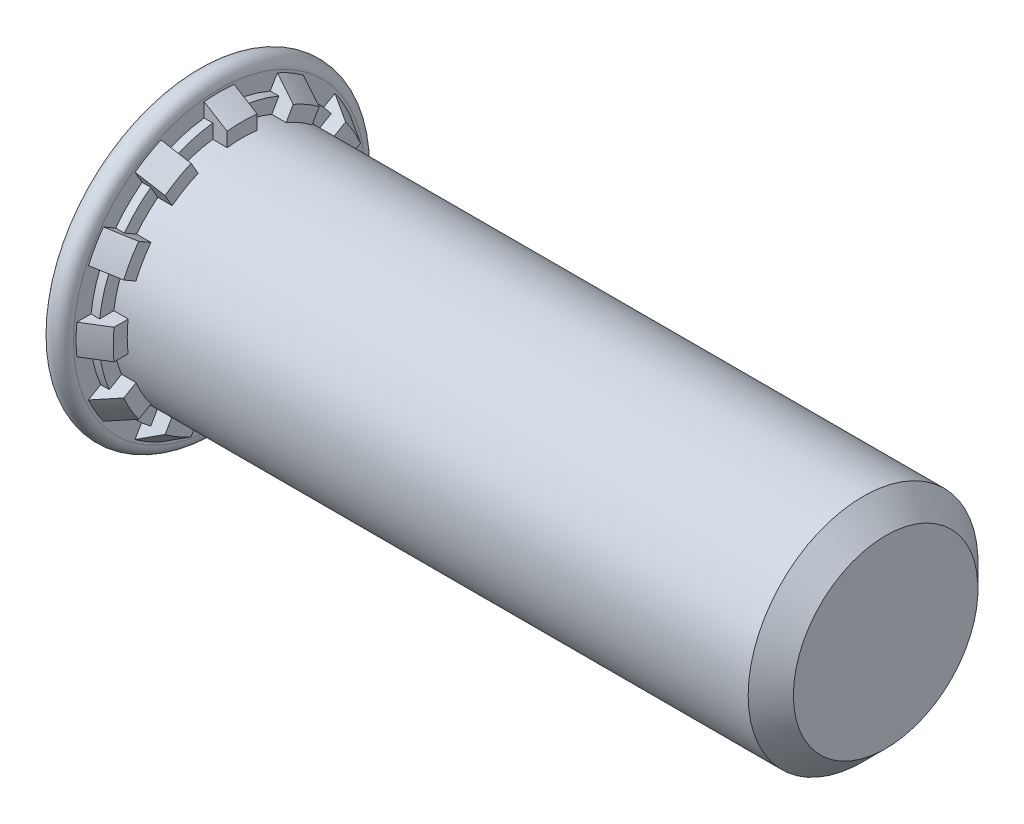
SolidWorks part; units mm, degrees
ref_plane "Plane1" through (0, 0, 0) normal (0, 0, 1) x (1, 0, 0)
ref_plane "Plane2" through (0, 0, 0) normal (0, 1, 0) x (1, 0, 0)
ref_plane "Plane3" through (0, 0, 0) normal (1, 0, 0) x (0, 0, -1)
sketch "BodySke" plane through (0, 0, 0) normal (0, 0, 1) x (1, 0, 0)
  line L0 (0, 0) -> (0, 3.7975)
  line L1 (0.6, 3.8025) -> (0.6, 3.735)
  line L2 (0.6, 3.735) -> (1.2, 3.3675)
  line L3 (1.2, 3) -> (17.4095, 3)
  line L4 (18, 2.4095) -> (18, 0)
  line L5 (18, 0) -> (0, 0)
  line L6 (0, 0) -> (50.554, 0) construction
  line L7 (1.2, 3.3675) -> (1.2, 3)
  line L8 (18, 2.4095) -> (17.4095, 3)
  line L9 (-9.525, 4.1) -> (9.525, 4.1) construction
  line L11 (2.2, 19.05) -> (2.2, -3.175) construction
  line L13 (9.525, -4.1) -> (-9.525, -4.1) construction
  line L14 (0.0051, 3.8025) -> (0.0051, 3.7975)
  line L15 (0, 3.7975) -> (0.0051, 3.7975)
  arc A0 (0.0051, 3.8025) -> (0.6, 3.8025) centre (0.3025, 3.8025) cw
  dimension "D2" = 0.0051
  dimension "D1" = 0.0051
  dimension "Diameter" = 6
  dimension "Length" = 18
  dimension "Body_ch_ang" = 45
  dimension "Minor_dia" = 4.819
  dimension "Advance" = 1
  dimension "H_dia" = 8.2
  dimension "Shoulder_lower_dia" = 7.47
  dimension "Shoulder_upper_dia" = 6.735
  dimension "Shoulder_ht" = 1.2
  dimension "T_dim" = 0.6
revolve "BaseBody" add sketch "BodySke" angle 360 about L6
sketch "ThdSchSke" plane through (0, 0, 0) normal (0, 0, 1) x (1, 0, 0)
  line L0 (3, -2.4095) -> (2.5865, -3)
  line L1 (3, -2.4095) -> (3.4135, -3)
  line L2 (3.4135, -3) -> (3.4135, -3.75)
  line L3 (-3.175, 0) -> (5.1513, 0) construction
  line L5 (3.4135, -3.75) -> (2.5865, -3.75)
  line L6 (2.5865, -3.75) -> (2.5865, -3)
  line L7 (0, 3.7975) -> (0, -3.7975) construction
  dimension "Thread_minor" = 4.819
  dimension "Diameter" = 6
  dimension "Start" = 3
  dimension "SideAngle" = 55
  dimension "VeeAngle" = 70
  dimension "Overcut" = 7.5
revolve "ThreadSchematic" [suppressed] cut sketch "ThdSchSke" angle 360 about L3
pattern_linear "ThdSchPat" [suppressed]
sketch "RibCut1Ske" plane through (1.2, 0, 0) normal (1, 0, 0) x (0, 0, -1)
  line L0 (0.3916, 2.9743) -> (0.3916, 4.0813)
  line L1 (1.1481, 2.7716) -> (1.7015, 3.7303)
  line L2 (0, 0) -> (0, 4.9784) construction
  line L3 (0, 0) -> (0.3916, 2.9743) construction
  line L4 (0, 0) -> (1.1481, 2.7716) construction
  arc A1 (1.1481, 2.7716) -> (0.3916, 2.9743) centre (0, 0) ccw
  arc A2 (1.7015, 3.7303) -> (0.3916, 4.0813) centre (0, 0) ccw
  dimension "Inner_dia" = 6
  dimension "Outer_dia" = 8.2
  dimension "Rib_root_half_angle" = 7.5
  dimension "Rib_root_gap_angle" = 15
  dimension "Angle" = 30
extrude "RibCut1" cut sketch "RibCut1Ske" against normal blind 0.375
sketch "RibCut2Ske" plane through (1.2, 0, 0) normal (1, 0, 0) x (0, 0, -1)
  line L0 (0.3916, 3.3447) -> (0.3916, 4.0813)
  line L1 (1.3332, 3.0923) -> (1.7015, 3.7303)
  line L2 (0.3916, 2.9743) -> (0.3916, 4.7861) construction
  line L3 (0, 0) -> (0, 5.0239) construction
  line L4 (0, 0) -> (0.3916, 2.9743) construction
  line L5 (0, 0) -> (1.1481, 2.7716) construction
  line L6 (1.1481, 2.7716) -> (2.0575, 4.3468) construction
  arc A1 (1.3332, 3.0923) -> (0.3916, 3.3447) centre (0, 0) ccw
  arc A2 (1.7015, 3.7303) -> (0.3916, 4.0813) centre (0, 0) ccw
  circle A4 centre (0, 0) radius 3 construction
  dimension "Inner_dia" = 6.735
  dimension "Outer_dia" = 8.2
  dimension "Rib_root_dia" = 6
  dimension "Rib_root_half_angle" = 7.5
  dimension "Rib_root_gap_angle" = 15
  dimension "Angle" = 30
extrude "RibCut2" cut sketch "RibCut2Ske" against normal blind 0.6
pattern_circular "RibCutsPat" count 12 every 30 about axis through (0, 0, 0) along (1, 0, 0) of "RibCut2", "RibCut1"
equation "' \"Length@BodySke\" = 18"
equation "' \"H_dia@BodySke\" = 8.2"
equation "' \"Start@ThdSchSke\" = 3"
equation "' \"Diameter@BodySke\" = 6"
equation "' \"Minor_dia@BodySke\" = 4.819"
equation "' \"Advance@BodySke\" = 1"
equation "\"T_dim@BodySke\" = \"Start@ThdSchSke\" * 0.2"
equation "\"Shoulder_ht@BodySke\" = \"Start@ThdSchSke\" * 0.4"
equation "\"Shoulder_lower_dia@BodySke\" = \"H_dia@BodySke\" - \"Start@ThdSchSke\" * 0.2 - .13"
equation "\"Shoulder_upper_dia@BodySke\" = ( \"Shoulder_lower_dia@BodySke\" + \"Diameter@BodySke\" ) /2"
equation "\"Num_ribs@RibCutsPat\" = 12"
equation "\"Angle@RibCutsPat\" = 360 / \"Num_ribs@RibCutsPat\""
equation "\"Angle@RibCut1Ske\" =\"Angle@RibCutsPat\""
equation "\"Rib_root_half_angle@RibCut1Ske\" = \"Angle@RibCut1Ske\" / 4"
equation "\"Rib_root_gap_angle@RibCut1Ske\" = \"Angle@RibCut1Ske\" - (2 * \"Rib_root_half_angle@RibCut1Ske\" )"
equation "\"Inner_dia@RibCut1Ske\" = \"Diameter@BodySke\""
equation "\"Outer_dia@RibCut1Ske\" = \"H_dia@BodySke\""
equation "\"Depth@RibCut1\" =  \"Start@ThdSchSke\" * 0.125"
equation "\"Angle@RibCut2Ske\" =\"Angle@RibCutsPat\""
equation "\"Rib_root_half_angle@RibCut2Ske\" = \"Angle@RibCut1Ske\" / 4"
equation "\"Rib_root_gap_angle@RibCut2Ske\" = \"Angle@RibCut1Ske\" - (2 * \"Rib_root_half_angle@RibCut1Ske\" )"
equation "\"Rib_root_dia@RibCut2Ske\" = \"Diameter@BodySke\""
equation "\"Inner_dia@RibCut2Ske\" = \"Shoulder_upper_dia@BodySke\""
equation "\"Outer_dia@RibCut2Ske\" = \"H_dia@BodySke\""
equation "\"Depth@RibCut2\" =  \"Start@ThdSchSke\" * 0.2"
equation "\"Thread_length@ThreadCosmetic\" = \"Length@BodySke\" - \"Start@ThdSchSke\""
equation "\"Thread_minor@ThreadCosmetic\" = \"Minor_dia@BodySke\""
equation "\"Thread_minor@ThdSchSke\" = \"Minor_dia@BodySke\""
equation "\"Diameter@ThdSchSke\" = \"Diameter@BodySke\""
equation "\"Overcut@ThdSchSke\" = \"Diameter@BodySke\" * 1.25"
equation "\"Num_threads@ThdSchPat\" = int( \"Thread_length@ThreadCosmetic\" / \"Advance@BodySke\" + 0.999 )  + 1"
equation "\"Advance@ThdSchPat\" = \"Thread_length@ThreadCosmetic\" /  (\"Num_threads@ThdSchPat\" - 1) 'relax it"
equation "\"Num_threads@ThdSchPat\" = \"Num_threads@ThdSchPat\" - sgn( \"Num_threads@ThdSchPat\" - 1) '---chamfered tips only---"
